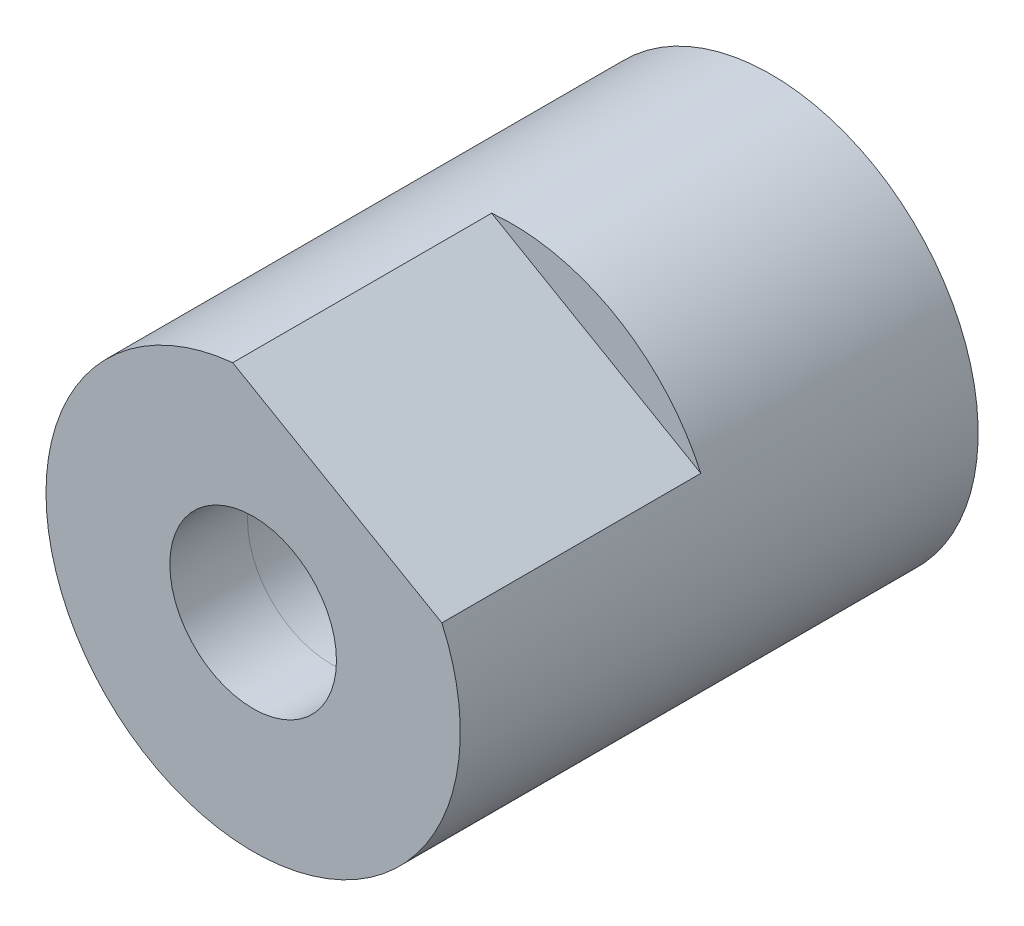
SolidWorks part; units mm, degrees
ref_plane "Front" through (0, 0, 0) normal (0, 0, 1) x (1, 0, 0)
ref_plane "Top" through (0, 0, 0) normal (0, 1, 0) x (1, 0, 0)
ref_plane "Right" through (0, 0, 0) normal (1, 0, 0) x (0, 0, -1)
sketch "Logo3_Revol_Axis" plane through (0, 0, 0) normal (0, 1, 0) x (1, 0, 0)
  line L0 (0, -30.1653) -> (0, 30.1653) construction
sketch "Logo3_bib1" plane through (0, 0, 0) normal (0, -1, 0) x (-1, 0, 0)
  line L0 (6.2025, 0) -> (5.1079, -26.9875)
  line L1 (5.1079, -31.75) -> (12.7, -31.75)
  line L2 (12.7, -31.75) -> (12.7, 0)
  line L8 (5.1079, -26.9875) -> (5.1079, -31.75)
  line L9 (12.7, 0) -> (6.2025, 0)
  line L10 (0, 41.5372) -> (0, -40.1764) construction
  dimension "logo3_d1" = 10.2159
  dimension "logo3_l1" = 31.75
  dimension "logo3_d2" = 12.405
  dimension "logo3_d3" = 25.4
  dimension "logo3_l2" = 4.7625
revolve "Revolve1" add sketch "Logo3_bib1" angle 360 about L10
sketch "Sketch1" plane through (0, 0, 31.75) normal (0, 0, 1) x (1, 0, 0)
  line L0 (-1.2523, 12.6381) -> (11.5711, 5.2345)
  line L1 (0, 11.9151) -> (0, 40.5456) construction
  circle A1 centre (0, 0) radius 12.7
  arc A2 (11.5711, 5.2345) -> (-1.2523, 12.6381) centre (0, 0) ccw
  dimension "D2" = 60
  dimension "D3" = 2.3813
  dimension "D1" = 0
extrude "Cut-Extrude1" cut sketch "Sketch1" against normal blind 15.875
other "Move Face1" [suppressed] parameters "D1"=180
